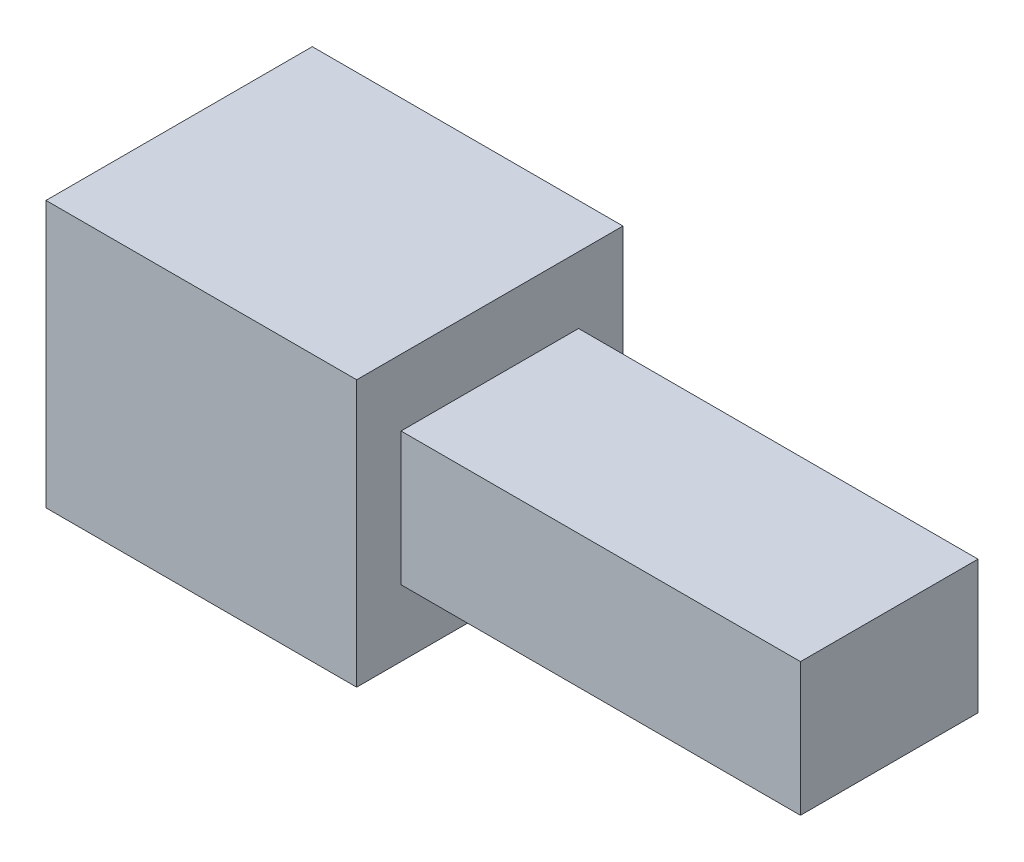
SolidWorks part; units mm, degrees
ref_plane "Front Plane" through (0, 0, 0) normal (0, 0, 1) x (1, 0, 0)
ref_plane "Top Plane" through (0, 0, 0) normal (0, 1, 0) x (1, 0, 0)
ref_plane "Right Plane" through (0, 0, 0) normal (1, 0, 0) x (0, 0, -1)
sketch "Sketch1" plane through (0, 0, 0) normal (1, 0, 0) x (0, 0, -1)
  line L1 (-2, 1.5) -> (2, 1.5)
  line L2 (-2, 1.5) -> (-2, -1.5)
  line L3 (-2, -1.5) -> (2, -1.5)
  line L4 (2, 1.5) -> (2, -1.5)
  line L5 (-2, 1.5) -> (2, -1.5) construction
  line L6 (-2, -1.5) -> (2, 1.5) construction
  point P0 (0, 0)
  dimension "D1" = 3
  dimension "D2" = 4
extrude "Boss-Extrude1" add sketch "Sketch1" along normal blind 10
sketch "Sketch4" plane through (0, 0, 0) normal (1, 0, 0) x (0, 0, -1)
  line L0 (1.3669, 1.46) -> (-1.3669, 1.46)
  line L3 (3, 3) -> (-3, 3)
  line L4 (3, 3) -> (3, -3)
  line L5 (3, -3) -> (-3, -3)
  line L6 (-3, 3) -> (-3, -3)
  line L7 (3, 3) -> (-3, -3) construction
  line L8 (3, -3) -> (-3, 3) construction
  arc A0 (-1.3669, 1.46) -> (1.3669, 1.46) centre (0, 0) ccw
  point P5 (0, 1.46)
  dimension "D1" = 4
  dimension "D2" = 6
  dimension "D3" = 6
extrude "Boss-Extrude18" add sketch "Sketch4" against normal blind 6 and the other way blind 1 from offset 0
